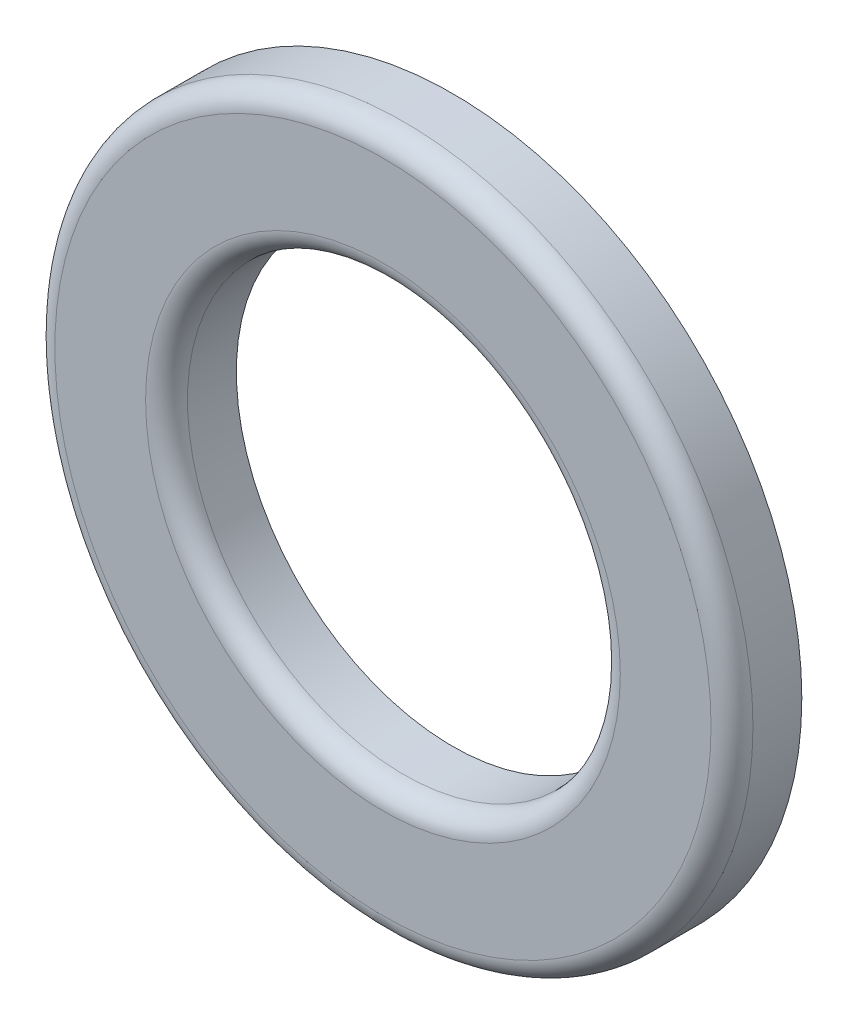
SolidWorks part; units mm, degrees
ref_plane "Plan1" through (0, 0, 0) normal (0, 0, 1) x (1, 0, 0)
ref_plane "Plan2" through (0, 0, 0) normal (0, 1, 0) x (1, 0, 0)
ref_plane "Plan3" through (0, 0, 0) normal (1, 0, 0) x (0, 0, -1)
sketch "Esquisse1" plane through (0, 0, 0) normal (0, 0, 1) x (1, 0, 0)
  circle A0 centre (0, 0) radius 3.1
  circle A1 centre (0, 0) radius 5
  dimension "D1" = 10
  dimension "D2" = 6.2
extrude "Base-Extrusion" add sketch "Esquisse1" along normal blind 1
fillet "Congé1" radius 0.3 2 edges at (5, 0, 1) (3.1, 0, 1)
